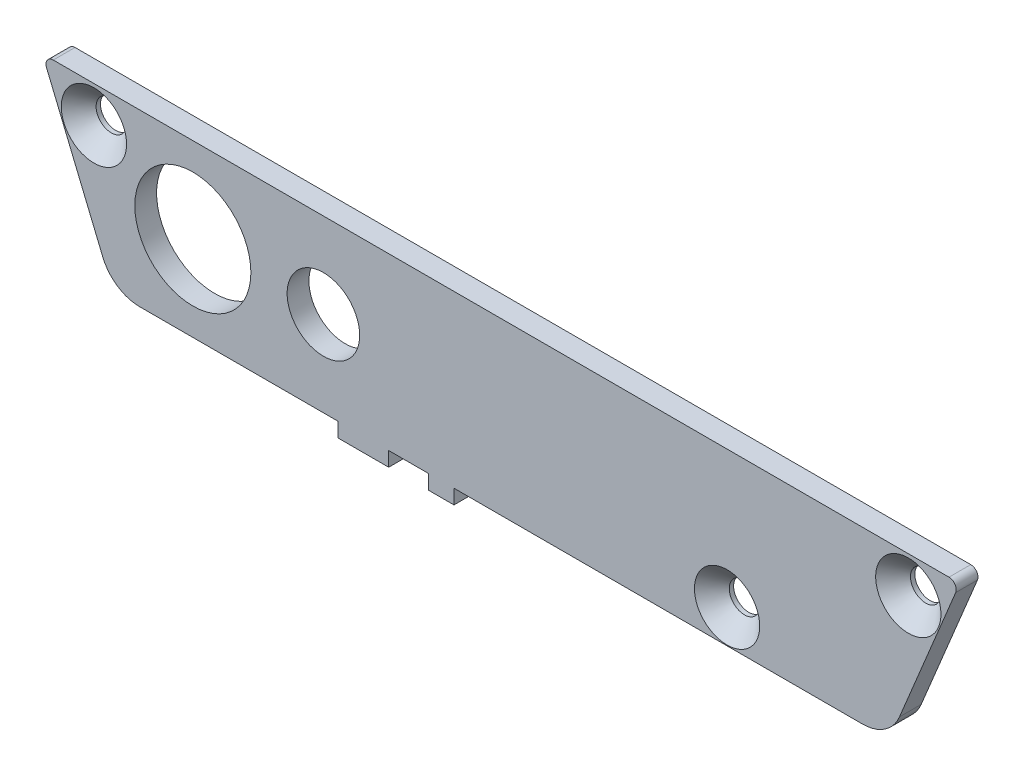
SolidWorks part; units mm, degrees
ref_plane "Plan de face" through (0, 0, 0) normal (0, 0, 1) x (1, 0, 0)
ref_plane "Plan de dessus" through (0, 0, 0) normal (0, 1, 0) x (1, 0, 0)
ref_plane "Plan de droite" through (0, 0, 0) normal (1, 0, 0) x (0, 0, -1)
sketch "Esquisse2" plane through (0, 0, 134.3496) normal (0, 0, 1) x (1, 0, 0)
  line L0 (130.5294, 76.8361) -> (7.0385, 76.8361) construction
  line L1 (130.5294, 76.8361) -> (7.0385, 76.8361)
  line L2 (6.1146, 75.4535) -> (13.8696, 56.7314) construction
  line L3 (6.1146, 75.4535) -> (13.8696, 56.7314)
  line L4 (18.9509, 53.3361) -> (46.284, 53.3361) construction
  line L5 (18.9509, 53.3361) -> (46.284, 53.3361)
  line L6 (123.6984, 56.7314) -> (131.4533, 75.4535) construction
  line L7 (123.6984, 56.7314) -> (131.4533, 75.4535)
  line L9 (62.284, 53.3361) -> (62.284, 51.3361) construction
  line L11 (62.284, 53.3361) -> (62.284, 51.3361)
  line L13 (58.784, 51.3361) -> (62.284, 51.3361) construction
  line L15 (58.784, 51.3361) -> (62.284, 51.3361)
  line L16 (58.784, 53.3361) -> (58.784, 51.3361) construction
  line L17 (58.784, 53.3361) -> (58.784, 51.3361)
  line L18 (53.284, 53.3361) -> (58.784, 53.3361) construction
  line L19 (62.284, 53.3361) -> (118.6171, 53.3361)
  line L20 (53.284, 53.3361) -> (58.784, 53.3361)
  line L21 (53.284, 51.3361) -> (53.284, 53.3361) construction
  line L22 (53.284, 51.3361) -> (53.284, 53.3361)
  line L23 (46.284, 51.3361) -> (53.284, 51.3361) construction
  line L24 (46.284, 51.3361) -> (53.284, 51.3361)
  line L25 (46.284, 53.3361) -> (46.284, 51.3361) construction
  line L26 (46.284, 53.3361) -> (46.284, 51.3361)
  arc A0 (7.0385, 76.8361) -> (6.1146, 75.4535) centre (7.0385, 75.8361) ccw construction
  arc A1 (7.0385, 76.8361) -> (6.1146, 75.4535) centre (7.0385, 75.8361) ccw
  arc A2 (13.8696, 56.7314) -> (17.0419, 53.6781) centre (18.9509, 58.8361) ccw construction
  arc A3 (13.8696, 56.7314) -> (17.0419, 53.6781) centre (18.9509, 58.8361) ccw
  arc A5 (17.0419, 53.6781) -> (18.9509, 53.3361) centre (18.9509, 58.8361) ccw
  arc A6 (118.6171, 53.3361) -> (123.6984, 56.7314) centre (118.6171, 58.8361) ccw construction
  arc A7 (118.6171, 53.3361) -> (123.6984, 56.7314) centre (118.6171, 58.8361) ccw
  arc A8 (131.4533, 75.4535) -> (130.5294, 76.8361) centre (130.5294, 75.8361) ccw construction
  arc A9 (131.4533, 75.4535) -> (130.5294, 76.8361) centre (130.5294, 75.8361) ccw
  point P12 (99.934, 57.9361)
  point P15 (12.6461, 71.8361)
  point P16 (124.9219, 71.8361)
extrude "Boss.-Extru.1" add sketch "Esquisse2" against normal blind 3
hole_wizard "Fraisage pour vis à tête fraisée M41" positions "Esquisse3" profile "Esquisse4" countersink size "M4" standard "ISO"
sketch "Esquisse3" plane through (0, 0, 134.3496) normal (0, 0, 1) x (1, 0, 0)
  point P0 (12.6461, 71.8361)
  point P3 (99.934, 57.9361)
  point P6 (124.9219, 71.8361)
sketch "Esquisse4" plane through (12.6461, 71.8361, 134.3496) normal (1, 0, 0) x (0, -1, 0)
  line L0 (0, 0) -> (0, 3)
  line L1 (0, 3) -> (2.1, 3)
  line L2 (2.1, 3) -> (2.1, 2.4)
  line L3 (2.1, 2.4) -> (4.5, 0)
  line L5 (4.5, 0) -> (0, 0)
  line L6 (-2.1, 2.4) -> (-4.5, 0) construction
  line L11 (0, -6.35) -> (0, 107.95) construction
  dimension "Diamètre du perçage jusqu'au prochain" = 4.2
  dimension "Profondeur du perçage jusqu'au prochain" = 3
  dimension "Diamètre du fraisage entrant" = 9
  dimension "Angle du fraisage entrant" = 90
sketch "Esquisse5" plane through (0, 0, 134.3496) normal (0, 0, 1) x (1, 0, 0)
  line L0 (68.784, 76.8361) -> (68.784, 53.3361) construction
  line L1 (130.5294, 76.8361) -> (7.0385, 76.8361) construction
  line L2 (62.284, 53.3361) -> (118.6171, 53.3361) construction
  line L3 (26.284, 65.0861) -> (44.284, 65.0861) construction
  circle A0 centre (26.284, 65.0861) radius 8
  circle A1 centre (111.284, 65.0861) radius 8 construction
  circle A2 centre (44.284, 65.0861) radius 5
  dimension "D1" = 16
  dimension "D3" = 10
  dimension "D2" = 18
extrude "Enlèv. mat.-Extru.1" cut sketch "Esquisse5" against normal up to next
